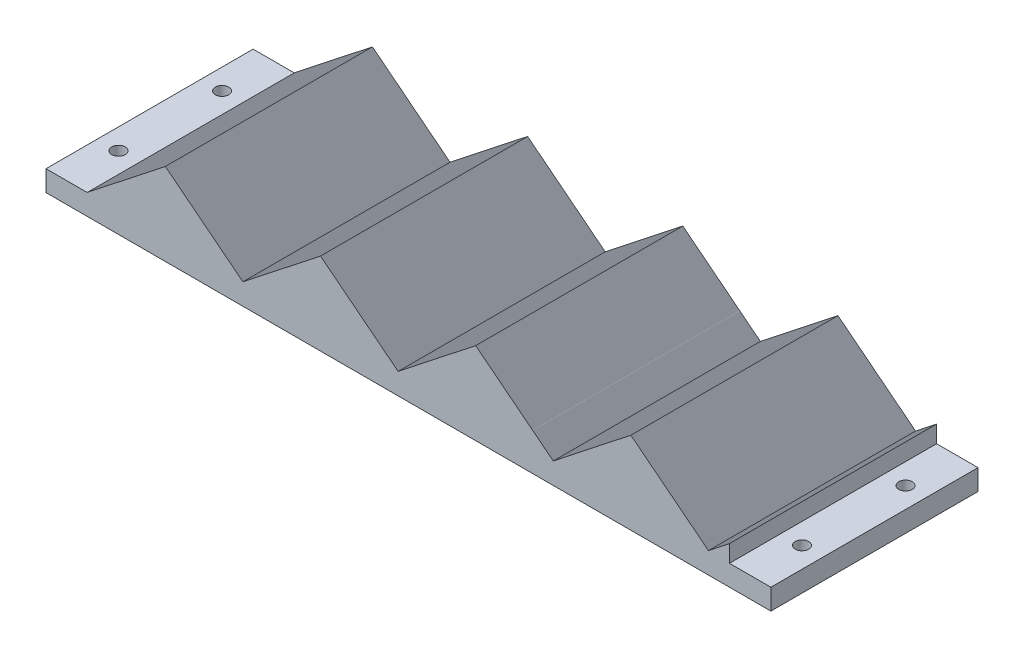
SolidWorks part; units mm, degrees
ref_plane "Front Plane" through (0, 0, 0) normal (0, 0, 1) x (1, 0, 0)
ref_plane "Top Plane" through (0, 0, 0) normal (0, 1, 0) x (1, 0, 0)
ref_plane "Right Plane" through (0, 0, 0) normal (1, 0, 0) x (0, 0, -1)
sketch "Model"
extrude "Boss-Extrude1" add sketch "Model" along normal blind 100
sketch "Sketch2" plane through (0, -10, 0) normal (0, -1, 0) x (1, 0, 0)
  line L0 (-20, 50) -> (330, 50) construction
  line L1 (-20, 100) -> (-20, 0) construction
  line L2 (330, 100) -> (330, 0) construction
  line L4 (-20, 100) -> (330, 100) construction
  line L5 (155, 100) -> (155, 0) construction
  line L6 (-20, 0) -> (330, 0) construction
  circle A0 centre (-10, 75) radius 3.25
  circle A1 centre (-10, 25) radius 3.25
  circle A2 centre (320, 25) radius 3.25
  circle A3 centre (320, 75) radius 3.25
  dimension "D1" = 6.5
  dimension "D2" = 25
  dimension "D3" = 10
extrude "Cut-Extrude1" cut sketch "Sketch2" against normal through all both and the other way through all
